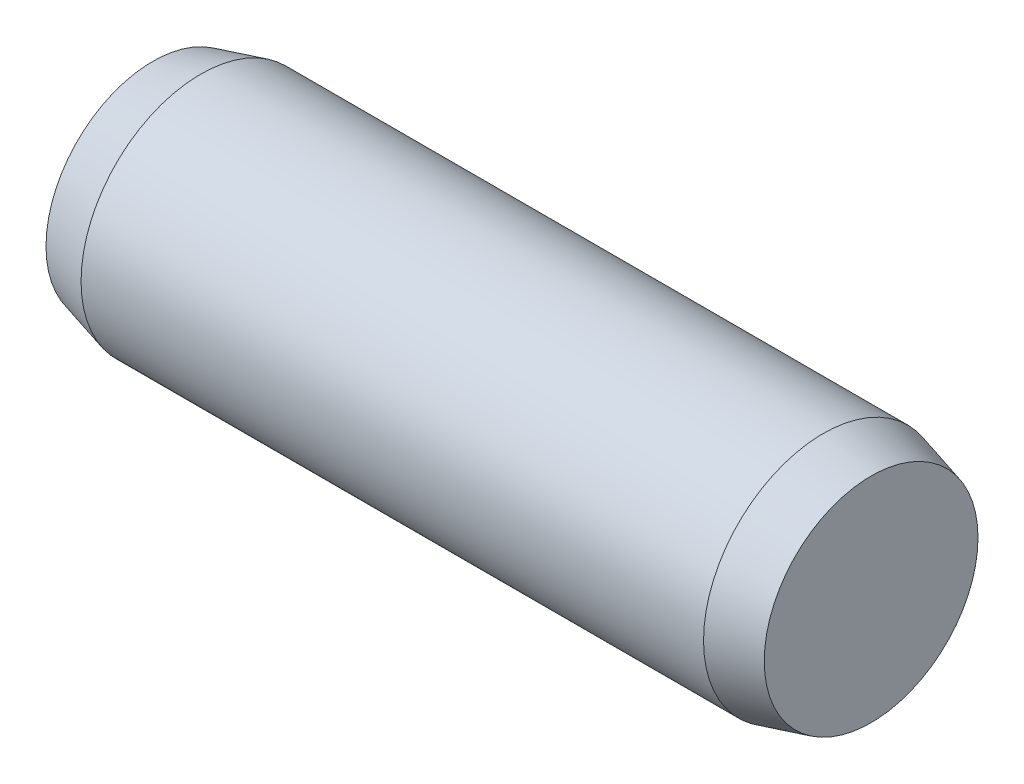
SolidWorks part; units mm, degrees
ref_plane "Front Plane" through (0, 0, 0) normal (0, 0, 1) x (1, 0, 0)
ref_plane "Top Plane" through (0, 0, 0) normal (0, 1, 0) x (1, 0, 0)
ref_plane "Right Plane" through (0, 0, 0) normal (1, 0, 0) x (0, 0, -1)
other "Configuration Table"
sketch "BodySke" plane through (0, 0, 0) normal (0, 1, 0) x (1, 0, 0)
  line L0 (0, 0) -> (33.9797, 0) construction
  line L1 (0, 5) -> (0, 0) construction
  line L2 (0, 5) -> (30, 5) construction
  line L3 (30, 5) -> (30, 0) construction
  line L4 (0, 0) -> (30, 0)
  line L5 (2, 5) -> (2, 0) construction
  line L6 (2, 5) -> (0, 4.4641)
  line L7 (15, 5) -> (15, 0) construction
  line L8 (28, 5) -> (30, 4.4641)
  line L9 (0, 4.4641) -> (0, 0)
  line L10 (30, 0) -> (30, 4.4641)
  line L11 (28, 5) -> (2, 5)
  dimension "Length" = 30
  dimension "Pin_dia" = 5
  dimension "Chamfer_length" = 2
  dimension "Ang" = 15
revolve "BaseBody" add sketch "BodySke" angle 360 about L0
